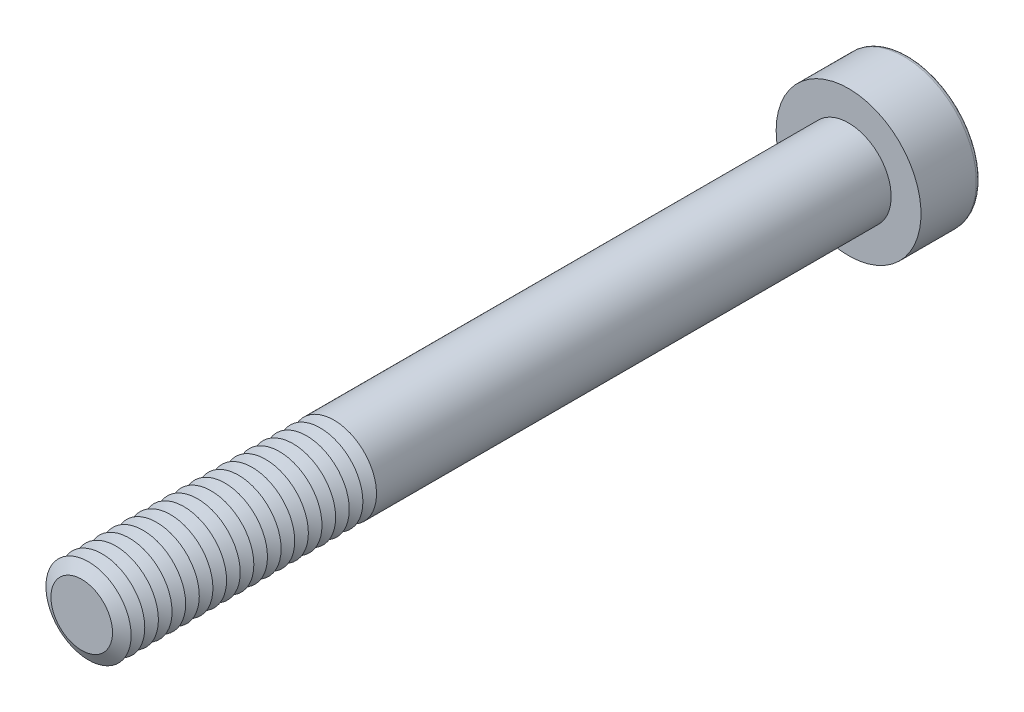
SolidWorks part; units mm, degrees
ref_plane "Front Plane" through (0, 0, 0) normal (0, 0, 1) x (1, 0, 0)
ref_plane "Top Plane" through (0, 0, 0) normal (0, 1, 0) x (1, 0, 0)
ref_plane "Right Plane" through (0, 0, 0) normal (1, 0, 0) x (0, 0, -1)
sketch "Sketch1" plane through (0, 0, 0) normal (0, 0, 1) x (1, 0, 0)
  circle A0 centre (0, 0) radius 2.5
  dimension "D1" = 5
extrude "Boss-Extrude1" add sketch "Sketch1" along normal blind 45
sketch "Sketch2" plane through (0, 0, 0) normal (0, 0, -1) x (-1, 0, 0)
  circle A0 centre (0, 0) radius 4.25
  dimension "D1" = 8.5
extrude "Boss-Extrude2" add sketch "Sketch2" along normal blind 3.5
sketch "Sketch3" plane through (0, 0, -3.5) normal (0, 0, -1) x (-1, 0, 0)
  line L1 (-0.866, 1.5) -> (-1.7321, 0)
  line L2 (-1.7321, 0) -> (-0.866, -1.5)
  line L3 (-0.866, -1.5) -> (0.866, -1.5)
  line L4 (0.866, -1.5) -> (1.7321, 0)
  line L5 (1.7321, 0) -> (0.866, 1.5)
  line L6 (0.866, 1.5) -> (-0.866, 1.5)
  circle A0 centre (0, 0) radius 1.5 construction
  dimension "D1" = 3
extrude "Cut-Extrude1" cut sketch "Sketch3" against normal blind 2.25
fillet "Fillet1" radius 0.25 1 edges at (-4.25, 0, -3.5)
sketch "Sketch4" plane through (0, 0, -1.25) normal (0, 0, -1) x (-1, 0, 0)
  line L0 (0.866, -1.5) -> (1.7321, 0) construction
  circle A0 centre (0, 0) radius 1.5
extrude "Cut-Extrude2" cut sketch "Sketch4" against normal through all draft 60
sketch "Sketch5" plane through (0, 0, -3.5) normal (0, 0, -1) x (-1, 0, 0)
  circle A0 centre (0, 0) radius 1.7321
extrude "Cut-Extrude3" cut sketch "Sketch5" against normal through all draft 75
sketch "Sketch7" plane through (0, 0, 0) normal (1, 0, 0) x (0, 0, -1)
  line L25 (-45, 1.8072) -> (-44.6, 2.5)
  line L26 (-45, 2.5) -> (-45, -2.5) construction
  line L27 (-44.6, 2.5) -> (-45.4, 2.5)
  line L28 (-45.4, 2.5) -> (-45, 1.8072)
  line L29 (0, 2.5) -> (-45, 2.5) construction
  dimension "D1" = 0.8
revolve "Cut-Revolve1" cut sketch "Sketch7" angle 360 about axis through (0, 0, 45) along (0, 0, -1)
pattern_linear "LPattern1" count 19 spacing 0.8 along (0, 0, -1) of "Cut-Revolve1"
